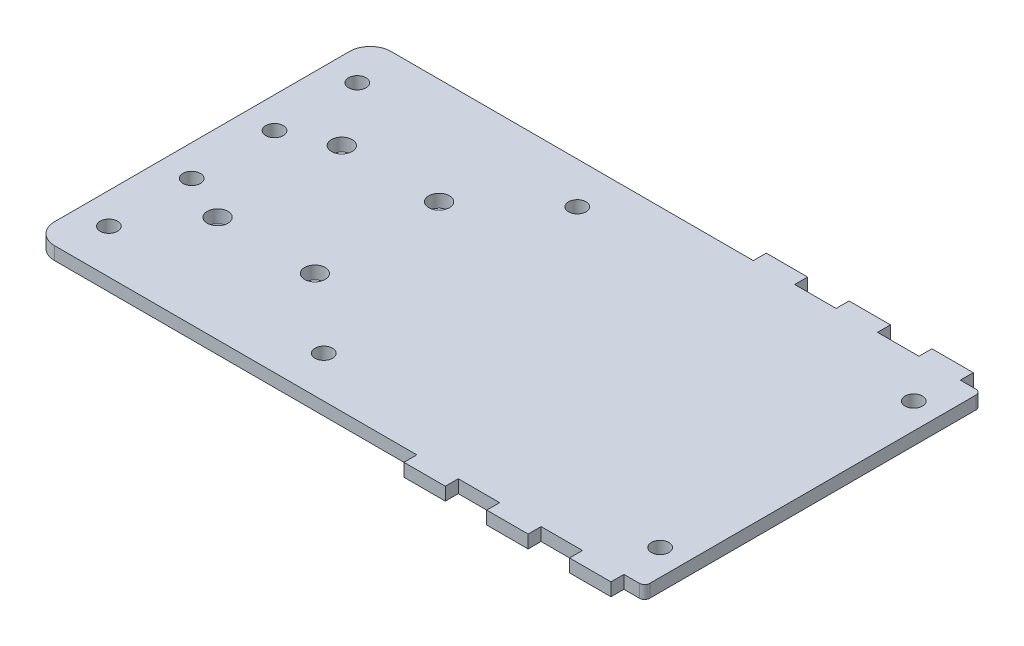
SolidWorks part; units mm, degrees
ref_plane "Front Plane" through (0, 0, 0) normal (0, 0, 1) x (1, 0, 0)
ref_plane "Top Plane" through (0, 0, 0) normal (0, 1, 0) x (1, 0, 0)
ref_plane "Right Plane" through (0, 0, 0) normal (1, 0, 0) x (0, 0, -1)
sketch "Sketch1" plane through (0, 0, 0) normal (0, 1, 0) x (1, 0, 0)
  line L0 (38.1, -41.275) -> (48.26, -41.275)
  line L1 (76.2, -41.275) -> (-76.2, -41.275)
  line L2 (76.2, -41.275) -> (76.2, 41.275)
  line L3 (76.2, 41.275) -> (-76.2, 41.275)
  line L4 (-76.2, -41.275) -> (-76.2, 41.275)
  line L5 (76.2, -41.275) -> (-76.2, 41.275) construction
  line L6 (76.2, 41.275) -> (-76.2, -41.275) construction
  line L7 (58.42, -41.275) -> (68.58, -41.275)
  line L8 (58.42, -41.275) -> (58.42, -44.45)
  line L9 (58.42, -44.45) -> (68.58, -44.45)
  line L10 (68.58, -41.275) -> (68.58, -44.45)
  line L11 (38.1, -41.275) -> (38.1, -44.45)
  line L12 (38.1, -44.45) -> (48.26, -44.45)
  line L13 (48.26, -41.275) -> (48.26, -44.45)
  line L14 (17.78, -41.275) -> (27.94, -41.275)
  line L15 (17.78, -41.275) -> (17.78, -44.45)
  line L16 (17.78, -44.45) -> (27.94, -44.45)
  line L17 (27.94, -41.275) -> (27.94, -44.45)
  line L18 (58.42, 44.45) -> (68.58, 44.45)
  line L19 (58.42, 44.45) -> (58.42, 41.275)
  line L20 (58.42, 41.275) -> (68.58, 41.275)
  line L21 (68.58, 44.45) -> (68.58, 41.275)
  line L22 (38.1, 44.45) -> (48.26, 44.45)
  line L23 (38.1, 44.45) -> (38.1, 41.275)
  line L24 (38.1, 41.275) -> (48.26, 41.275)
  line L25 (48.26, 44.45) -> (48.26, 41.275)
  line L26 (17.78, 44.45) -> (27.94, 44.45)
  line L27 (17.78, 44.45) -> (17.78, 41.275)
  line L28 (17.78, 41.275) -> (27.94, 41.275)
  line L29 (27.94, 44.45) -> (27.94, 41.275)
  line L30 (58.42, -41.275) -> (38.1, -41.275) construction
  point P0 (0, 0)
  dimension "D1" = 3.175
  dimension "D2" = 10.16
  dimension "D5" = 20.32
  dimension "D6" = 82.55
  dimension "D7" = 152.4
  dimension "D8" = 7.62
  dimension "D3" = 3
  dimension "D4" = 2
extrude "Main Extrude" add sketch "Sketch1" along normal blind 3.175 contours L17 L1 L15 L16 | L4 L1 L0 L2 L3 | L13 L0 L11 L12 | L29 L26 L27 L3 | L10 L9 L8 L7 | L18 L21 L20 L19 | L22 L25 L24 L23
sketch "Sketch2" plane through (0, 3.175, 0) normal (0, 1, 0) x (1, 0, 0)
  line L0 (-57.15, 15.24) -> (-57.15, -15.24) construction
  line L1 (-57.15, 0) -> (-76.2, 0) construction
  line L2 (-76.2, -41.275) -> (-76.2, 41.275) construction
  circle A0 centre (-57.15, 15.24) radius 2.54
  circle A1 centre (-33.274, 15.24) radius 2.54
  circle A2 centre (-33.274, -15.24) radius 2.54
  circle A3 centre (-57.15, -15.24) radius 2.54
  dimension "D4" = 23.876
  dimension "D5" = 5.08
  dimension "D3" = 30.48
  dimension "D6" = 19.05
  dimension "D1" = 2
  dimension "D2" = 2
extrude "Caster Mounting Holes" cut sketch "Sketch2" against normal through all
sketch "Sketch3" plane through (0, 3.175, 0) normal (0, 1, 0) x (1, 0, 0)
  line L0 (76.2, -41.275) -> (76.2, 41.275) construction
  line L1 (73.66, 41.275) -> (76.2, 41.275)
  line L2 (73.66, 41.275) -> (73.66, -41.275)
  line L3 (73.66, -41.275) -> (76.2, -41.275)
  line L4 (76.2, 41.275) -> (76.2, -41.275)
  dimension "D1" = 2.54
extrude "Remove Uneven Back Edge" cut sketch "Sketch3" against normal through all
sketch "Sketch5" plane through (0, 3.175, 0) normal (0, 1, 0) x (1, 0, 0)
  line L0 (-21.59, 41.275) -> (73.66, -41.275) construction
  line L1 (-21.59, 41.275) -> (73.66, 41.275) construction
  line L2 (-21.59, 41.275) -> (-21.59, -41.275) construction
  line L3 (-21.59, -41.275) -> (73.66, -41.275) construction
  line L4 (73.66, 41.275) -> (73.66, -41.275) construction
  line L5 (73.66, 41.275) -> (-21.59, -41.275) construction
  line L7 (67.31, -31.115) -> (-15.24, -31.115) construction
  line L8 (67.31, -31.115) -> (67.31, 31.115) construction
  line L9 (67.31, 31.115) -> (-15.24, 31.115) construction
  line L10 (-15.24, -31.115) -> (-15.24, 31.115) construction
  line L11 (67.31, -31.115) -> (-15.24, 31.115) construction
  line L12 (67.31, 31.115) -> (-15.24, -31.115) construction
  circle A0 centre (-15.24, 31.115) radius 2.15
  circle A1 centre (67.31, 31.115) radius 2.15
  circle A2 centre (67.31, -31.115) radius 2.15
  circle A3 centre (-15.24, -31.115) radius 2.15
  point P4 (26.035, 0)
  point P10 (26.035, 0)
  dimension "D5" = 4.3
  dimension "D1" = 95.25
  dimension "D2" = 82.55
  dimension "D3" = 82.55
  dimension "D4" = 62.23
extrude "Standoff Holes" cut sketch "Sketch5" against normal through all
fillet "Fillet1" radius 5.08 2 edges at (-76.2, 1.5875, 41.275) (-76.2, 1.5875, -41.275)
fillet "Fillet2" radius 1.27 1 edges at (73.66, 1.5875, 41.275)
fillet "Fillet3" radius 1.27 1 edges at (73.66, 1.5875, -41.275)
sketch "Sketch9" plane through (0, 3.175, 0) normal (0, 1, 0) x (1, 0, 0)
  line L0 (-76.2, -36.195) -> (-76.2, 36.195) construction
  line L1 (-68.58, -30.48) -> (-68.58, -41.275) construction
  line L2 (17.78, -41.275) -> (-71.12, -41.275) construction
  line L3 (-68.58, 30.48) -> (-68.58, 41.275) construction
  line L4 (17.78, 41.275) -> (-71.12, 41.275) construction
  circle A0 centre (-68.58, -30.48) radius 2.15
  circle A1 centre (-68.58, -10.16) radius 2.15
  circle A2 centre (-68.58, 10.16) radius 2.15
  circle A3 centre (-68.58, 30.48) radius 2.15
  dimension "D1" = 7.62
  dimension "D2" = 4.3
  dimension "D3" = 4
extrude "Front Mounting Holes" cut sketch "Sketch9" against normal through all
sketch "Sketch7" plane through (0, 3.175, 0) normal (0, 1, 0) x (1, 0, 0)
  line L544 (73.7362, -40.005) -> (73.7362, 40.005)
  line L545 (72.39, 41.3512) -> (68.6562, 41.3512)
  line L546 (68.6562, 41.3512) -> (68.6562, 44.5262)
  line L547 (68.6562, 44.5262) -> (58.3438, 44.5262)
  line L548 (58.3438, 44.5262) -> (58.3438, 41.3512)
  line L549 (58.3438, 41.3512) -> (48.3362, 41.3512)
  line L550 (48.3362, 41.3512) -> (48.3362, 44.5262)
  line L551 (48.3362, 44.5262) -> (38.0238, 44.5262)
  line L552 (38.0238, 44.5262) -> (38.0238, 41.3512)
  line L553 (38.0238, 41.3512) -> (28.0162, 41.3512)
  line L554 (28.0162, 41.3512) -> (28.0162, 44.5262)
  line L555 (28.0162, 44.5262) -> (17.7038, 44.5262)
  line L556 (17.7038, 44.5262) -> (17.7038, 41.3512)
  line L557 (17.7038, 41.3512) -> (-71.12, 41.3512)
  line L558 (-76.2762, 36.195) -> (-76.2762, -36.195)
  line L559 (-71.12, -41.3512) -> (17.7038, -41.3512)
  line L560 (17.7038, -41.3512) -> (17.7038, -44.5262)
  line L561 (17.7038, -44.5262) -> (28.0162, -44.5262)
  line L562 (28.0162, -44.5262) -> (28.0162, -41.3512)
  line L563 (28.0162, -41.3512) -> (38.0238, -41.3512)
  line L564 (38.0238, -41.3512) -> (38.0238, -44.5262)
  line L565 (38.0238, -44.5262) -> (48.3362, -44.5262)
  line L566 (48.3362, -44.5262) -> (48.3362, -41.3512)
  line L567 (48.3362, -41.3512) -> (58.3438, -41.3512)
  line L568 (58.3438, -41.3512) -> (58.3438, -44.5262)
  line L569 (58.3438, -44.5262) -> (68.6562, -44.5262)
  line L570 (68.6562, -44.5262) -> (68.6562, -41.3512)
  line L571 (68.6562, -41.3512) -> (72.39, -41.3512)
  line L572 (73.7362, -40.005) -> (73.7362, 40.005)
  line L573 (72.39, 41.3512) -> (68.6562, 41.3512)
  line L574 (68.6562, 41.3512) -> (68.6562, 44.5262)
  line L575 (68.6562, 44.5262) -> (58.3438, 44.5262)
  line L576 (58.3438, 44.5262) -> (58.3438, 41.3512)
  line L577 (58.3438, 41.3512) -> (48.3362, 41.3512)
  line L578 (48.3362, 41.3512) -> (48.3362, 44.5262)
  line L579 (48.3362, 44.5262) -> (38.0238, 44.5262)
  line L580 (38.0238, 44.5262) -> (38.0238, 41.3512)
  line L581 (38.0238, 41.3512) -> (28.0162, 41.3512)
  line L582 (28.0162, 41.3512) -> (28.0162, 44.5262)
  line L583 (28.0162, 44.5262) -> (17.7038, 44.5262)
  line L584 (17.7038, 44.5262) -> (17.7038, 41.3512)
  line L585 (17.7038, 41.3512) -> (-71.12, 41.3512)
  line L586 (-76.2762, 36.195) -> (-76.2762, -36.195)
  line L587 (-71.12, -41.3512) -> (17.7038, -41.3512)
  line L588 (17.7038, -41.3512) -> (17.7038, -44.5262)
  line L589 (17.7038, -44.5262) -> (28.0162, -44.5262)
  line L590 (28.0162, -44.5262) -> (28.0162, -41.3512)
  line L591 (28.0162, -41.3512) -> (38.0238, -41.3512)
  line L592 (38.0238, -41.3512) -> (38.0238, -44.5262)
  line L593 (38.0238, -44.5262) -> (48.3362, -44.5262)
  line L594 (48.3362, -44.5262) -> (48.3362, -41.3512)
  line L595 (48.3362, -41.3512) -> (58.3438, -41.3512)
  line L596 (58.3438, -41.3512) -> (58.3438, -44.5262)
  line L597 (58.3438, -44.5262) -> (68.6562, -44.5262)
  line L598 (68.6562, -44.5262) -> (68.6562, -41.3512)
  line L599 (68.6562, -41.3512) -> (72.39, -41.3512)
  circle A46 centre (67.31, -31.115) radius 2.0738
  circle A47 centre (67.31, -31.115) radius 2.0738
  arc A48 (72.39, -41.3512) -> (73.7362, -40.005) centre (72.39, -40.005) ccw
  arc A49 (73.7362, 40.005) -> (72.39, 41.3512) centre (72.39, 40.005) ccw
  arc A50 (-71.12, 41.3512) -> (-76.2762, 36.195) centre (-71.12, 36.195) ccw
  arc A51 (-76.2762, -36.195) -> (-71.12, -41.3512) centre (-71.12, -36.195) ccw
  arc A52 (72.39, -41.3512) -> (73.7362, -40.005) centre (72.39, -40.005) ccw
  arc A53 (73.7362, 40.005) -> (72.39, 41.3512) centre (72.39, 40.005) ccw
  arc A54 (-71.12, 41.3512) -> (-76.2762, 36.195) centre (-71.12, 36.195) ccw
  arc A55 (-76.2762, -36.195) -> (-71.12, -41.3512) centre (-71.12, -36.195) ccw
  circle A57 centre (67.31, 31.115) radius 2.0738
  circle A58 centre (67.31, 31.115) radius 2.0738
  circle A60 centre (-15.24, -31.115) radius 2.0738
  circle A61 centre (-15.24, -31.115) radius 2.0738
  circle A63 centre (-33.274, -15.24) radius 2.4638
  circle A64 centre (-33.274, -15.24) radius 2.4638
  circle A66 centre (-57.15, -15.24) radius 2.4638
  circle A67 centre (-57.15, -15.24) radius 2.4638
  circle A69 centre (-33.274, 15.24) radius 2.4638
  circle A70 centre (-33.274, 15.24) radius 2.4638
  circle A72 centre (-57.15, 15.24) radius 2.4638
  circle A73 centre (-57.15, 15.24) radius 2.4638
  circle A75 centre (-15.24, 31.115) radius 2.0738
  circle A76 centre (-15.24, 31.115) radius 2.0738
  circle A80 centre (-68.58, -30.48) radius 2.0738
  circle A81 centre (-68.58, -30.48) radius 2.0738
  circle A83 centre (-68.58, -10.16) radius 2.0738
  circle A84 centre (-68.58, -10.16) radius 2.0738
  circle A86 centre (-68.58, 10.16) radius 2.0738
  circle A87 centre (-68.58, 10.16) radius 2.0738
  circle A89 centre (-68.58, 30.48) radius 2.0738
  circle A90 centre (-68.58, 30.48) radius 2.0738
  dimension "D1" = 0.0762
  dimension "D2" = 0.0762
  dimension "D3" = 0.0762
  dimension "D4" = 0.0762
  dimension "D5" = 0.0762
  dimension "D6" = 0.0762
  dimension "D7" = 0.0762
  dimension "D8" = 0.0762
  dimension "D9" = 0.0762
  dimension "D10" = 0.0762
  dimension "D11" = 0.0762
  dimension "D12" = 0.0762
  dimension "D13" = 0.0762
